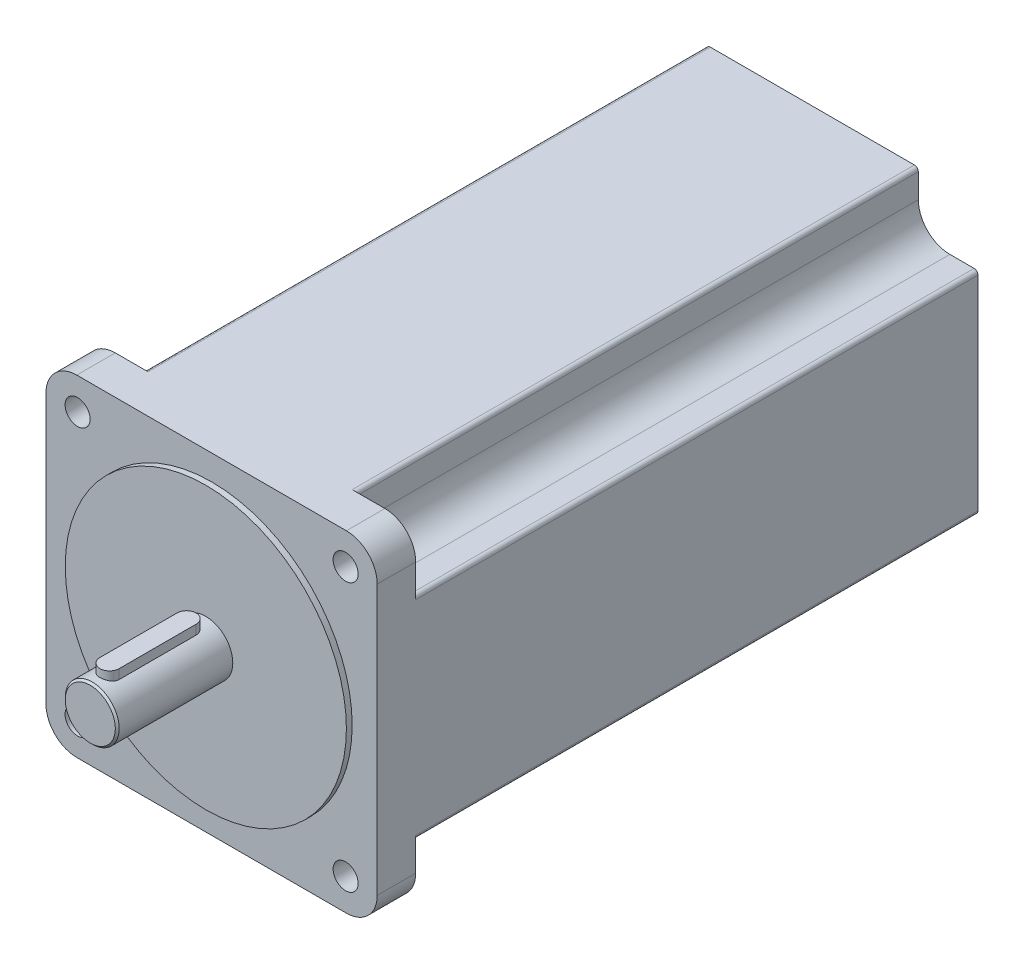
SolidWorks part; units mm, degrees
ref_plane "前视基准面" through (0, 0, 0) normal (0, 0, 1) x (1, 0, 0)
ref_plane "上视基准面" through (0, 0, 0) normal (0, 1, 0) x (1, 0, 0)
ref_plane "右视基准面" through (0, 0, 0) normal (1, 0, 0) x (0, 0, -1)
sketch "草图1" plane through (0, 0, 0) normal (0, 0, 1) x (1, 0, 0)
  circle A0 centre (0, 0) radius 36.5
extrude "凸台-拉伸1" add sketch "草图1" against normal blind 1.5
sketch "草图2" plane through (0, 0, 0) normal (0, 0, 1) x (1, 0, 0)
  circle A0 centre (0, 0) radius 7
extrude "凸台-拉伸2" add sketch "草图2" along normal blind 30
sketch "草图4" plane through (0, 0, -1.5) normal (0, 0, -1) x (-1, 0, 0)
  line L1 (0, 43) -> (35, 43)
  line L2 (43, 35) -> (43, -35)
  line L3 (35, -43) -> (-35, -43)
  line L4 (-43, -35) -> (-43, 35)
  line L5 (-35, 43) -> (0, 43)
  arc A0 (-35, -43) -> (-43, -35) centre (-35, -35) cw
  arc A1 (43, -35) -> (35, -43) centre (35, -35) cw
  arc A2 (35, 43) -> (43, 35) centre (35, 35) cw
  arc A3 (-43, 35) -> (-35, 43) centre (-35, 35) cw
  circle A4 centre (-34.8, 34.8) radius 3.25
  circle A5 centre (34.8, 34.8) radius 3.25
  circle A6 centre (34.8, -34.8) radius 3.25
  circle A7 centre (-34.8, -34.8) radius 3.25
  dimension "D1" = 8
extrude "凸台-拉伸3" add sketch "草图4" along normal blind 156
sketch "草图5" plane through (0, 0, -157.5) normal (0, 0, -1) x (-1, 0, 0)
  line L1 (35, 43) -> (-35, 43) construction
  line L2 (13.75, 43) -> (26.5, 43)
  line L3 (27.5, 42) -> (27.5, 35.7)
  line L4 (35.7, 27.5) -> (42, 27.5)
  line L5 (43, -35) -> (43, 35) construction
  line L6 (43, 26.5) -> (43, 18.141)
  line L7 (43, 18.141) -> (50.5715, 18.141)
  line L8 (50.5715, 18.141) -> (50.5715, 56.8276)
  line L9 (50.5715, 56.8276) -> (13.75, 56.8276)
  line L10 (13.75, 56.8276) -> (13.75, 43)
  line L12 (-13.75, 56.8276) -> (-13.75, 43)
  line L13 (-50.5715, 56.8276) -> (-13.75, 56.8276)
  line L14 (-50.5715, 18.141) -> (-50.5715, 56.8276)
  line L15 (-43, 18.141) -> (-50.5715, 18.141)
  line L16 (-43, 26.5) -> (-43, 18.141)
  line L17 (-35.7, 27.5) -> (-42, 27.5)
  line L18 (-27.5, 42) -> (-27.5, 35.7)
  line L19 (-13.75, 43) -> (-26.5, 43)
  line L20 (13.75, -56.8276) -> (13.75, -43)
  line L21 (50.5715, -56.8276) -> (13.75, -56.8276)
  line L22 (50.5715, -18.141) -> (50.5715, -56.8276)
  line L23 (43, -18.141) -> (50.5715, -18.141)
  line L24 (43, -26.5) -> (43, -18.141)
  line L25 (35.7, -27.5) -> (42, -27.5)
  line L26 (27.5, -42) -> (27.5, -35.7)
  line L27 (13.75, -43) -> (26.5, -43)
  line L28 (-13.75, -43) -> (-26.5, -43)
  line L29 (-27.5, -42) -> (-27.5, -35.7)
  line L30 (-35.7, -27.5) -> (-42, -27.5)
  line L31 (-43, -26.5) -> (-43, -18.141)
  line L32 (-43, -18.141) -> (-50.5715, -18.141)
  line L33 (-50.5715, -18.141) -> (-50.5715, -56.8276)
  line L34 (-50.5715, -56.8276) -> (-13.75, -56.8276)
  line L35 (-13.75, -56.8276) -> (-13.75, -43)
  arc A0 (27.5, 35.7) -> (35.7, 27.5) centre (35.7, 35.7) ccw
  arc A1 (42, 27.5) -> (43, 26.5) centre (42, 26.5) cw
  arc A2 (26.5, 43) -> (27.5, 42) centre (26.5, 42) cw
  arc A3 (-26.5, 43) -> (-27.5, 42) centre (-26.5, 42) ccw
  arc A4 (-42, 27.5) -> (-43, 26.5) centre (-42, 26.5) ccw
  arc A5 (-27.5, 35.7) -> (-35.7, 27.5) centre (-35.7, 35.7) cw
  arc A6 (26.5, -43) -> (27.5, -42) centre (26.5, -42) ccw
  arc A7 (42, -27.5) -> (43, -26.5) centre (42, -26.5) ccw
  arc A8 (27.5, -35.7) -> (35.7, -27.5) centre (35.7, -35.7) cw
  arc A9 (-27.5, -35.7) -> (-35.7, -27.5) centre (-35.7, -35.7) ccw
  arc A10 (-42, -27.5) -> (-43, -26.5) centre (-42, -26.5) cw
  arc A11 (-26.5, -43) -> (-27.5, -42) centre (-26.5, -42) cw
  point P19 (43, 27.5)
  point P22 (27.5, 43)
  point P38 (-27.5, 43)
  point P39 (-43, 27.5)
  point P54 (27.5, -43)
  point P55 (43, -27.5)
  point P70 (-43, -27.5)
  point P71 (-27.5, -43)
  dimension "D1" = 8.2
  dimension "D2" = 1
extrude "切除-拉伸2" cut sketch "草图5" against normal blind 146
ref_plane "基准面1" through (0, 7, 0) normal (0, 1, 0) x (1, 0, 0)
sketch "草图6" plane through (0, 7, 0) normal (0, 1, 0) x (1, 0, 0)
  line L3 (-2.5, -5) -> (-2.5, -25)
  line L5 (2.5, -25) -> (2.5, -5)
  arc A0 (-2.5, -25) -> (2.5, -25) centre (0, -25) ccw
  arc A1 (2.5, -5) -> (-2.5, -5) centre (0, -5) ccw
extrude "切除-拉伸3" cut sketch "草图6" against normal blind 3 contours L5 A1 L3 A0
sketch "草图7" plane through (0, 4, 0) normal (0, 1, 0) x (1, 0, 0)
  line L0 (-2.5, -25) -> (-2.5, -5)
  line L2 (2.5, -5) -> (2.5, -25)
  arc A0 (2.5, -5) -> (-2.5, -5) centre (0, -5) ccw
  arc A1 (-2.5, -25) -> (2.5, -25) centre (0, -25) ccw
extrude "凸台-拉伸4" add sketch "草图7" along normal blind 5 separate body
chamfer "倒角1" distance 0.5 angle 45 1 edges at (7, 0, 30)
